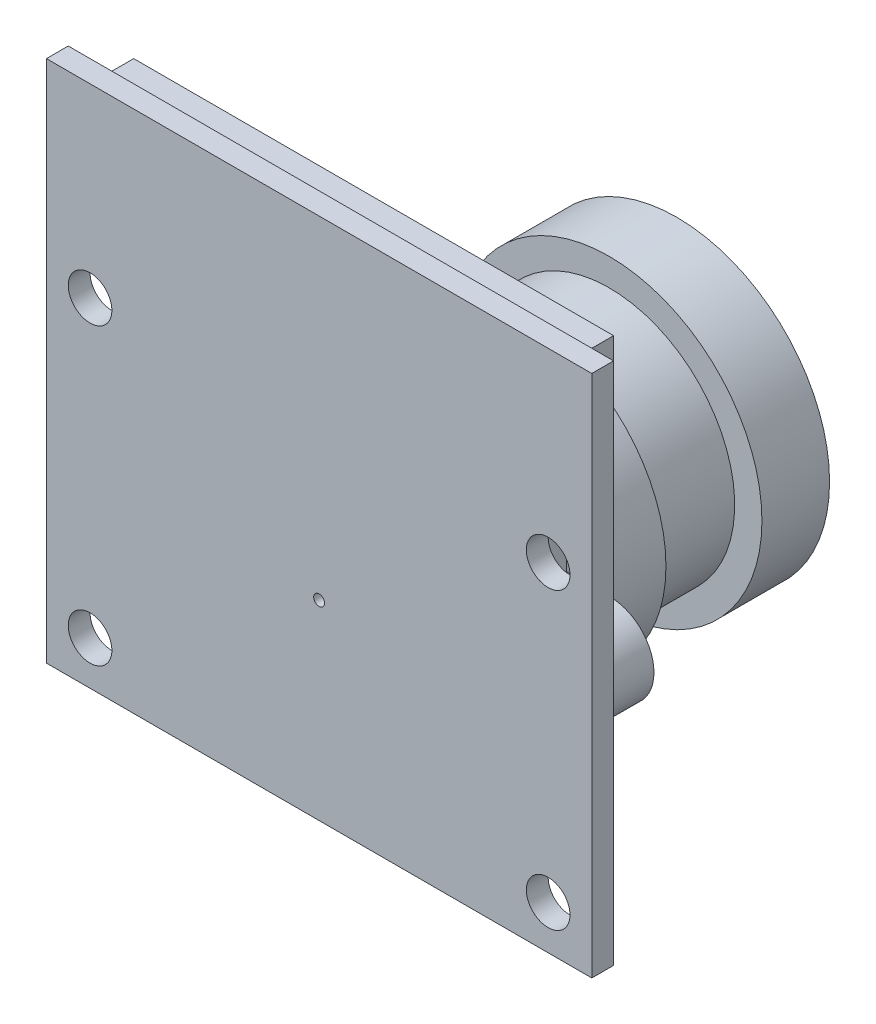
SolidWorks part; units mm, degrees
ref_plane "Спереди" through (0, 0, 0) normal (0, 0, 1) x (1, 0, 0)
ref_plane "Сверху" through (0, 0, 0) normal (0, 1, 0) x (1, 0, 0)
ref_plane "Справа" through (0, 0, 0) normal (1, 0, 0) x (0, 0, -1)
ref_plane "Плоскость4" through (0, 0, -1) normal (0, 0, -1) x (-1, 0, 0)
sketch "Эскиз1" plane through (0, 0, -1) normal (0, 0, -1) x (-1, 0, 0)
  line L0 (-25, 0) -> (0, 0)
  line L1 (0, 0) -> (0, 24)
  line L2 (0, 24) -> (-25, 24)
  line L3 (-25, 24) -> (-25, 0)
extrude "плата" add sketch "Эскиз1" against normal blind 1
sketch "Эскиз2" plane through (0, 0, -1) normal (0, 0, -1) x (-1, 0, 0)
  line L0 (-5.95, 10.75) -> (-3.95, 10.75)
  line L1 (-3.95, 6.75) -> (-5.95, 6.75)
  line L2 (-5.95, 6.75) -> (-5.95, 2.2)
  line L3 (-5.95, 2.2) -> (-19.05, 2.2)
  line L4 (-19.05, 2.2) -> (-19.05, 6.75)
  line L5 (-19.05, 6.75) -> (-21.05, 6.75)
  line L6 (-21.05, 10.75) -> (-19.05, 10.75)
  line L7 (-19.05, 10.75) -> (-19.05, 15.3)
  line L8 (-19.05, 15.3) -> (-5.95, 15.3)
  line L9 (-5.95, 15.3) -> (-5.95, 10.75)
  arc A0 (-3.95, 10.75) -> (-3.95, 6.75) centre (-3.95, 8.75) cw
  arc A1 (-21.05, 6.75) -> (-21.05, 10.75) centre (-21.05, 8.75) cw
extrude "выступ" add sketch "Эскиз2" along normal blind 3.8
sketch "Эскиз3" plane through (0, 0, -1) normal (0, 0, -1) x (-1, 0, 0)
  line L0 (-23.5, 18.6977) -> (-23.5, 23.5)
  line L1 (-23.5, 23.5) -> (-1.5, 23.5)
  line L2 (-1.5, 23.5) -> (-1.5, 18.6977)
  line L3 (-1.5, 18.6977) -> (-23.5, 18.6977)
extrude "разъем шлейфа" add sketch "Эскиз3" along normal blind 1.5
ref_plane "Плоскость5" through (0, 8.75, 0) normal (0, -1, 0) x (1, 0, 0)
sketch "Эскиз4" plane through (0, 8.75, 0) normal (0, -1, 0) x (1, 0, 0)
  line L0 (19.1, -4.8) -> (12.5, -4.8)
  line L1 (12.5, -4.8) -> (12.5, -16.4)
  line L2 (12.5, -16.4) -> (19.5, -16.4)
  line L3 (19.5, -16.4) -> (19.5, -13.3)
  line L4 (19.5, -13.3) -> (18.25, -13.3)
  line L5 (18.25, -13.3) -> (18.25, -9.3)
  line L6 (18.25, -9.3) -> (19.1, -9.3)
  line L7 (19.1, -9.3) -> (19.1, -4.8)
  line L8 (12.5, -4.8) -> (12.5, -16.4) construction
revolve "объектив" add sketch "Эскиз4" angle 360 about L8
hole_wizard "маленьекое отверстие" positions "Эскиз6" profile "Эскиз5" hole size "Ø0.5" standard "Ansi Metric"
sketch "Эскиз6" plane through (0, 0, 0) normal (0, 0, 1) x (1, 0, 0)
  point P0 (12.5, 8.75)
sketch "Эскиз5" plane through (12.5, 8.75, 0) normal (1, 0, 0) x (0, -1, 0)
  line L0 (0, 0) -> (0, 1)
  line L1 (0, 1) -> (0.25, 1)
  line L2 (0.25, 1) -> (0.25, 0)
  line L5 (0.25, 0) -> (0, 0)
  line L10 (0, 1) -> (-0.25, 1) construction
  line L11 (0, -6.35) -> (0, 107.95) construction
  dimension "Диаметр отверстия" = 0.5
  dimension "Глубина отверстия" = 1
  dimension "Угол заточки сверла" = 180
hole_wizard "крепежные отверстия" positions "Эскиз8" profile "Эскиз7" hole size "Ø2.0" standard "Ansi Metric"
sketch "Эскиз8" plane through (0, 0, 0) normal (0, 0, 1) x (1, 0, 0)
  point P0 (2, 2)
  point P1 (2, 15.5)
  point P2 (23, 15.5)
  point P3 (23, 2)
sketch "Эскиз7" plane through (2, 2, 0) normal (1, 0, 0) x (0, -1, 0)
  line L0 (0, 0) -> (0, 16.4)
  line L1 (0, 16.4) -> (1, 16.4)
  line L2 (1, 16.4) -> (1, 0)
  line L5 (1, 0) -> (0, 0)
  line L11 (0, -6.35) -> (0, 107.95) construction
  dimension "Диаметр сквозного отверстия" = 2
  dimension "Глубина сквозного отверстия" = 16.4
sketch "Эскиз10" plane through (0, 0, 0) normal (0, 0, 1) x (1, 0, 0)
  line L1 (23, 2) -> (2, 2)
  line L2 (23, 2) -> (23, 15.5)
  line L3 (23, 15.5) -> (2, 15.5)
  line L4 (2, 2) -> (2, 15.5)
  line L5 (23, 2) -> (2, 15.5) construction
  line L6 (23, 15.5) -> (2, 2) construction
  point P0 (12.5, 8.75)
  dimension "D1" = 21
  dimension "D2" = 13.5
  dimension "D3" = 6.75
ref_plane "Плоскость6" through (0, 8.75, 0) normal (0, 1, 0) x (1, 0, 0)
sketch "Эскиз11" plane through (0, 8.75, 0) normal (0, 1, 0) x (1, 0, 0)
  line L0 (5.5, 16.4) -> (-334.7769, 76.4)
  line L1 (19.5, 16.4) -> (359.7769, 76.4)
  line L2 (-334.7769, 76.4) -> (359.7769, 76.4)
  line L3 (19.5, 16.4) -> (5.5, 16.4) construction
  dimension "D1" = 160
  dimension "D2" = 60
